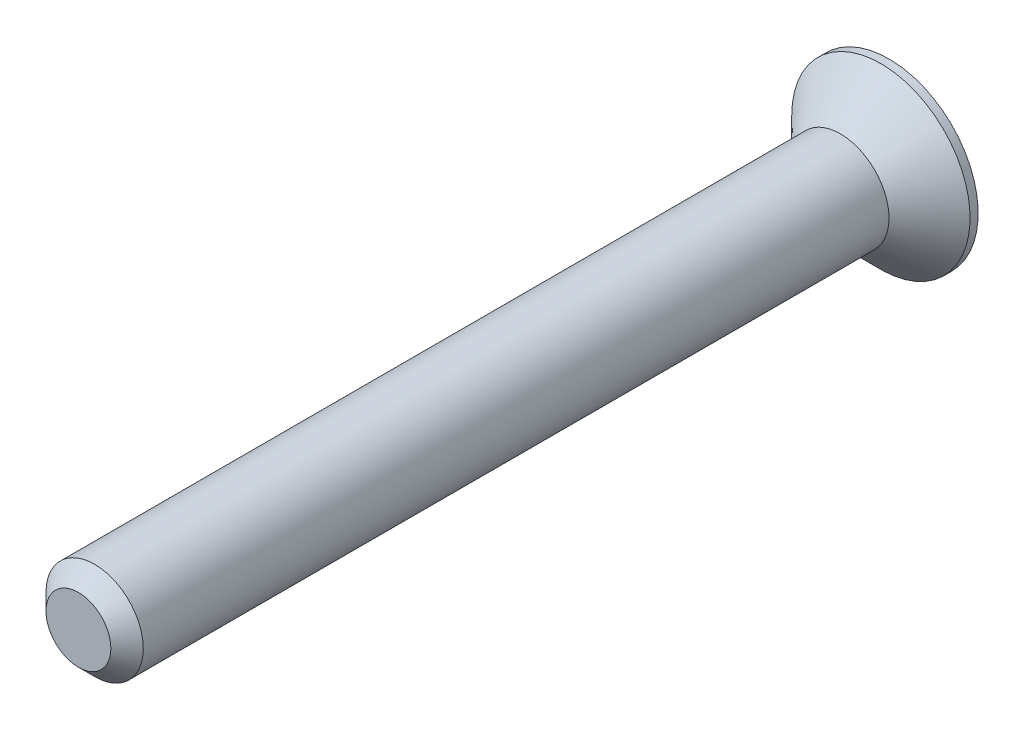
SolidWorks part; units mm, degrees
ref_plane "Плоскость1" through (0, 0, 0) normal (0, 0, 1) x (1, 0, 0)
ref_plane "Плоскость2" through (0, 0, 0) normal (0, 1, 0) x (1, 0, 0)
ref_plane "Плоскость3" through (0, 0, 0) normal (1, 0, 0) x (0, 0, -1)
sketch "Эскиз1" plane through (0, 0, 0) normal (0, 0, 1) x (1, 0, 0)
  circle A0 centre (-40, 30) radius 3
  dimension "D1" = 6
extrude "Основание-Вытянуть" add sketch "Эскиз1" along normal blind 47
sketch "Эскиз2" plane through (0, 0, 0) normal (0, 0, -1) x (-1, 0, 0)
  circle A0 centre (40, 30) radius 5.5
  dimension "D1" = 11
extrude "Бобышка-Вытянуть1" add sketch "Эскиз2" along normal blind 3
chamfer "Фаска1" distance 1 angle 45 1 edges at (-37, 30, 47)
chamfer "Фаска2" distance 2.5 angle 45 1 edges at (-45.5, 30, 0)
sketch "Эскиз3" plane through (0, 0, -3) normal (0, 0, -1) x (-1, 0, 0)
  line L0 (41, 31) -> (43, 31)
  line L1 (39, 27) -> (41, 27)
  line L2 (39, 27) -> (39, 29)
  line L3 (39, 33) -> (41, 33)
  line L4 (41, 27) -> (41, 29)
  line L5 (37, 31) -> (39, 31)
  line L6 (37, 31) -> (37, 29)
  line L7 (37, 29) -> (39, 29)
  line L8 (43, 31) -> (43, 29)
  line L9 (39, 31) -> (39, 33)
  line L10 (41, 29) -> (43, 29)
  line L11 (41, 31) -> (41, 33)
  circle A0 centre (40, 30) radius 5.5 construction
  circle A1 centre (40, 30) radius 5.5 construction
  dimension "D1" = 1
  dimension "D2" = 2
  dimension "D3" = 1
  dimension "D4" = 2
  dimension "D5" = 6
  dimension "D6" = 3
  dimension "D7" = 6
  dimension "D8" = 3
extrude "Вырез-Вытянуть1" cut sketch "Эскиз3" against normal blind 2.5
